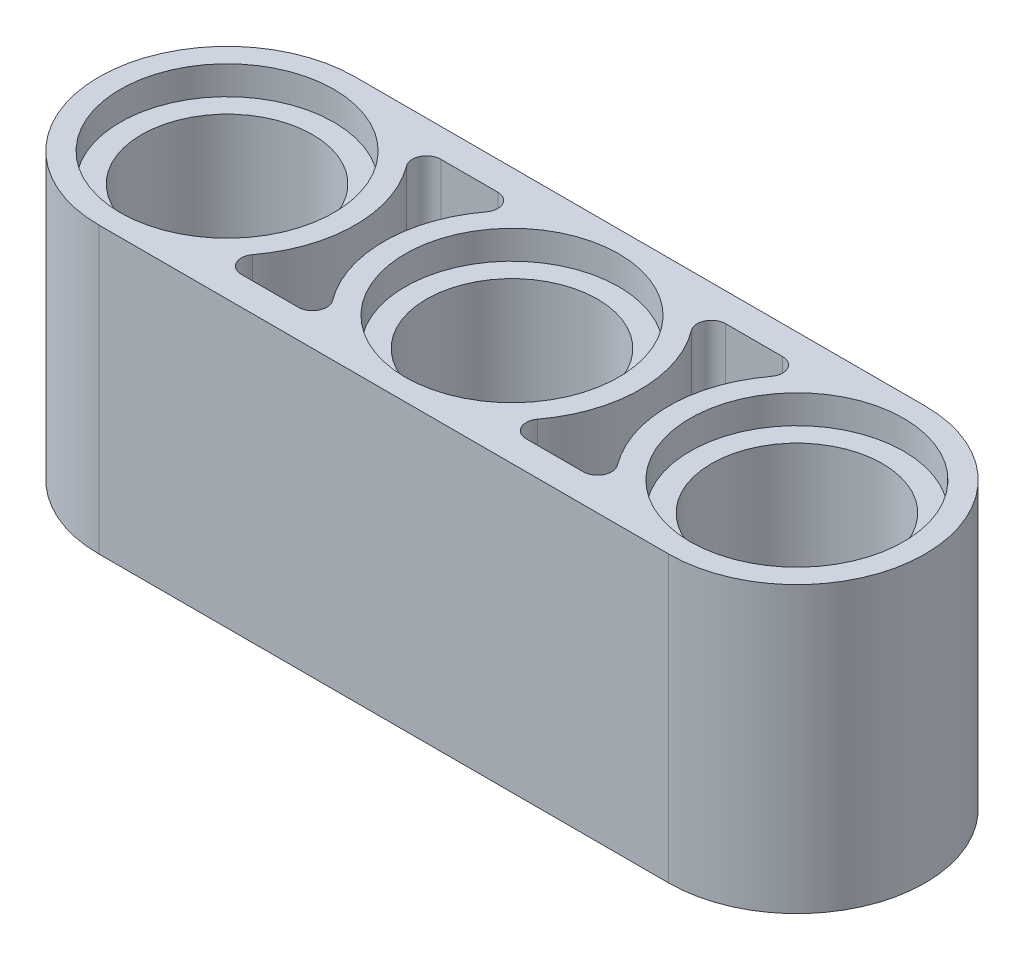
SolidWorks part; units mm, degrees
ref_plane "Front Plane" through (0, 0, 0) normal (0, 0, 1) x (1, 0, 0)
ref_plane "Top Plane" through (0, 0, 0) normal (0, 1, 0) x (1, 0, 0)
ref_plane "Right Plane" through (0, 0, 0) normal (1, 0, 0) x (0, 0, -1)
sketch "Sketch1" plane through (0, 0, 0) normal (0, 1, 0) x (1, 0, 0)
  line L6 (0, 3.6) -> (32, 3.6)
  line L7 (32, -3.6) -> (0, -3.6)
  circle A0 centre (0, 0) radius 2.4
  circle A1 centre (8, 0) radius 2.4
  circle A2 centre (16, 0) radius 2.4
  circle A3 centre (24, 0) radius 2.4
  circle A9 centre (32, 0) radius 2.4
  arc A14 (0, 3.6) -> (0, -3.6) centre (0, 0) ccw
  arc A15 (32, -3.6) -> (32, 3.6) centre (32, 0) ccw
  dimension "D1" = 4.8
  dimension "D4" = 3.6
  dimension "D5" = 8
  dimension "D3" = 3.6
  dimension "D2" = 5
extrude "Boss-Extrude1" add sketch "Sketch1" along normal blind 8
sketch "Sketch6" plane through (0, 8, 0) normal (0, 1, 0) x (1, 0, 0)
  line L0 (0, 0) -> (8, 0) construction
  circle A0 centre (0, 0) radius 3
  circle A1 centre (8, 0) radius 3
  circle A2 centre (16, 0) radius 3
  circle A3 centre (24, 0) radius 3
  circle A4 centre (32, 0) radius 3
  dimension "D1" = 6
  dimension "D2" = 8
extrude "Cut-Extrude4" cut sketch "Sketch6" against normal blind 0.8
sketch "Sketch7" plane through (0, 8, 0) normal (0, 1, 0) x (1, 0, 0)
  line L0 (3.2, 2.8) -> (4.8, 2.8)
  line L1 (4.8, -2.8) -> (3.2, -2.8)
  line L2 (32, 3.6) -> (0, 3.6) construction
  line L3 (0, -3.6) -> (32, -3.6) construction
  line L4 (11.2, 2.8) -> (12.8, 2.8)
  line L5 (12.8, -2.8) -> (11.2, -2.8)
  line L6 (19.2, 2.8) -> (20.8, 2.8)
  line L7 (20.8, -2.8) -> (19.2, -2.8)
  line L8 (27.2, 2.8) -> (28.8, 2.8)
  line L9 (28.8, -2.8) -> (27.2, -2.8)
  line L10 (3.2, 2.8) -> (11.2, 2.8) construction
  arc A0 (2.88, -2.16) -> (2.88, 2.16) centre (0, 0) ccw
  arc A1 (5.12, 2.16) -> (5.12, -2.16) centre (8, 0) ccw
  arc A2 (3.2, -2.8) -> (2.88, -2.16) centre (3.2, -2.4) cw
  arc A3 (4.8, -2.8) -> (5.12, -2.16) centre (4.8, -2.4) ccw
  arc A4 (4.8, 2.8) -> (5.12, 2.16) centre (4.8, 2.4) cw
  arc A5 (3.2, 2.8) -> (2.88, 2.16) centre (3.2, 2.4) ccw
  arc A6 (10.88, -2.16) -> (10.88, 2.16) centre (8, 0) ccw
  arc A7 (13.12, 2.16) -> (13.12, -2.16) centre (16, 0) ccw
  arc A8 (11.2, -2.8) -> (10.88, -2.16) centre (11.2, -2.4) cw
  arc A9 (12.8, -2.8) -> (13.12, -2.16) centre (12.8, -2.4) ccw
  arc A10 (12.8, 2.8) -> (13.12, 2.16) centre (12.8, 2.4) cw
  arc A11 (11.2, 2.8) -> (10.88, 2.16) centre (11.2, 2.4) ccw
  arc A12 (18.88, -2.16) -> (18.88, 2.16) centre (16, 0) ccw
  arc A13 (21.12, 2.16) -> (21.12, -2.16) centre (24, 0) ccw
  arc A14 (19.2, -2.8) -> (18.88, -2.16) centre (19.2, -2.4) cw
  arc A15 (20.8, -2.8) -> (21.12, -2.16) centre (20.8, -2.4) ccw
  arc A16 (20.8, 2.8) -> (21.12, 2.16) centre (20.8, 2.4) cw
  arc A17 (19.2, 2.8) -> (18.88, 2.16) centre (19.2, 2.4) ccw
  arc A18 (26.88, -2.16) -> (26.88, 2.16) centre (24, 0) ccw
  arc A19 (29.12, 2.16) -> (29.12, -2.16) centre (32, 0) ccw
  arc A20 (27.2, -2.8) -> (26.88, -2.16) centre (27.2, -2.4) cw
  arc A21 (28.8, -2.8) -> (29.12, -2.16) centre (28.8, -2.4) ccw
  arc A22 (28.8, 2.8) -> (29.12, 2.16) centre (28.8, 2.4) cw
  arc A23 (27.2, 2.8) -> (26.88, 2.16) centre (27.2, 2.4) ccw
  dimension "D3" = 0.4
  dimension "D1" = 0.8
  dimension "D2" = 0.8
  dimension "D4" = 8
extrude "Cut-Extrude5" cut sketch "Sketch7" against normal blind 3.2
ref_plane "Plane3" through (0, 4, 0) normal (0, 1, 0) x (1, 0, 0)
mirror "Mirror2" about plane through (0, 4, 0) normal (0, 1, 0) of "Cut-Extrude5", "Cut-Extrude4"
sketch "Sketch8" plane through (0, 0, 0) normal (0, -1, 0) x (1, 0, 0)
  line L1 (24, 3.6) -> (32, 3.6)
  line L2 (24, -3.6) -> (32, -3.6)
  line L3 (0, 3.6) -> (32, 3.6) construction
  line L4 (16, 3.6) -> (24, 3.6)
  line L5 (16, -3.6) -> (24, -3.6)
  arc A1 (32, 3.6) -> (32, -3.6) centre (32, 0) cw
  arc A2 (16, -3.6) -> (16, 3.6) centre (16, 0) ccw
extrude "Cut-Extrude6" cut sketch "Sketch8" against normal up to surface (8 mm away)
